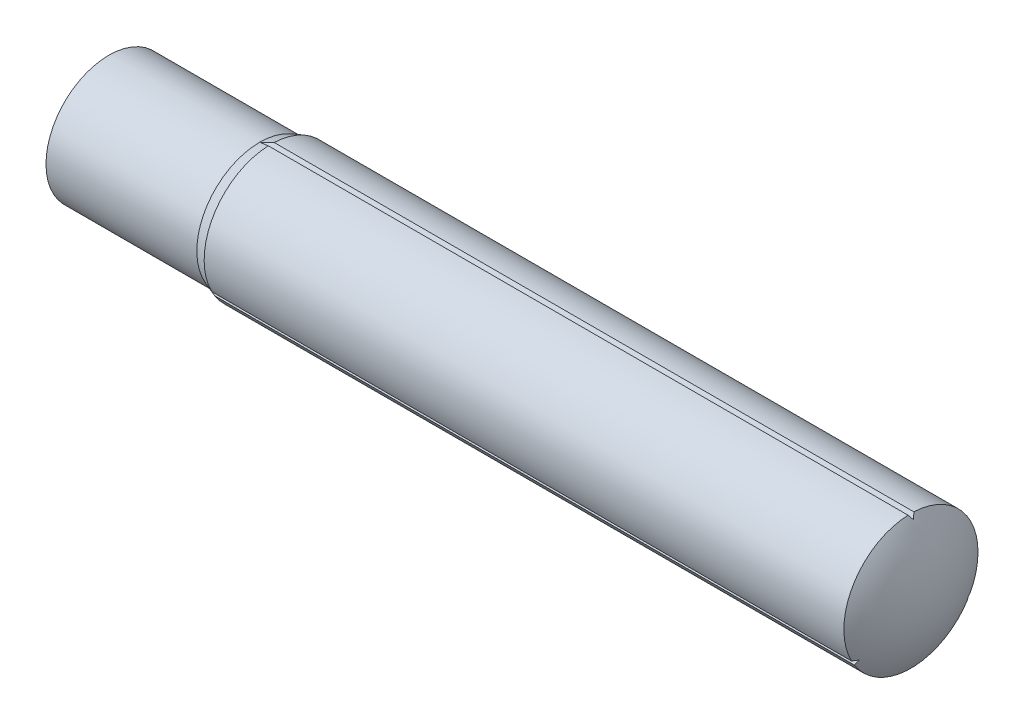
SolidWorks part; units mm, degrees
ref_plane "Front" through (0, 0, 0) normal (0, 0, 1) x (1, 0, 0)
ref_plane "Top" through (0, 0, 0) normal (0, 1, 0) x (1, 0, 0)
ref_plane "Right" through (0, 0, 0) normal (1, 0, 0) x (0, 0, -1)
sketch "Sketch1" plane through (0, 0, 0) normal (0, 0, 1) x (1, 0, 0)
  line L0 (0, 0) -> (10, 0)
  line L1 (-11.1634, 0) -> (0.7473, 0) construction
  line L3 (9.7689, 0.8) -> (2.1374, 0.8)
  line L4 (2.1374, 0.8) -> (2, 0.75)
  line L5 (2, 0.75) -> (0.201, 0.75)
  arc A0 (0.201, 0.75) -> (0, 0) centre (1.5, 0) ccw
  arc A1 (9.7689, 0.8) -> (10, 0) centre (8.5, 0) cw
  dimension "r1" = 1.5
  dimension "r" = 1.5
  dimension "l" = 10
  dimension "l1" = 2
  dimension "d" = 1.5
  dimension "d2" = 1.6
  dimension "D7" = 20
revolve "Base-Revolve" add sketch "Sketch1" angle 360 about L1
sketch "Sketch5" plane through (0, 0, 0) normal (0, 0, 1) x (1, 0, 0)
  line L1 (2, 0.75) -> (0.201, 0.75)
  line L3 (2.1374, 0.8) -> (2, 0.75)
  line L4 (2.1374, 0.8) -> (0.2311, 0.8)
  line L6 (-10.4052, 0) -> (0.33, 0) construction
  line L8 (9.7689, 0.8) -> (2.1374, 0.8) construction
  line L9 (2, 0.75) -> (0.201, 0.75) construction
  arc A0 (0.201, 0.75) -> (0.201, -0.75) centre (1.5, 0) ccw construction
  arc A1 (0.2311, 0.8) -> (0.201, 0.75) centre (1.5, 0) ccw
revolve "Revolve1" [suppressed] add sketch "Sketch5" angle 360 about L6
sketch "Sketch2" plane through (0, 0, 0) normal (1, 0, 0) x (0, 0, -1)
  line L0 (-0.035, 0.8) -> (0, 0.75)
  line L1 (0, 0.75) -> (0.035, 0.8)
  line L2 (0.035, 0.8) -> (-0.035, 0.8)
  line L3 (0, 1.2136) -> (0, -0.2002) construction
  dimension "D1" = 70
  dimension "D2" = 35
  dimension "D3" = 0.8
  dimension "D4" = 0.75
extrude "Cut-Extrude1" cut sketch "Sketch2" along normal through all
pattern_circular "CirPattern1" count 3 over 360 about axis through (0, 0, 0) along (1, 0, 0) of "Cut-Extrude1"
equation "\"r@Sketch1\" = \"d@Sketch1\""
equation "\"r1@Sketch1\" = \"r@Sketch1\""
equation "\"D3@Sketch2\" = \"d2@Sketch1\" / 2"
equation "\"D4@Sketch2\" = \"d@Sketch1\" / 2"
